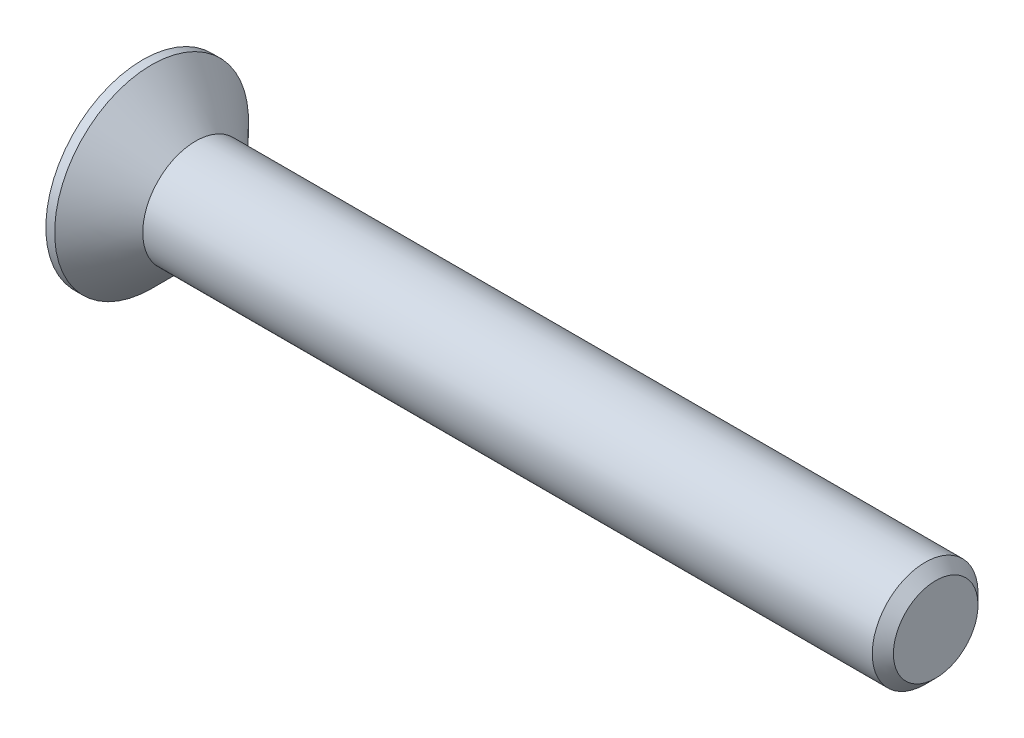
SolidWorks part; units mm, degrees
ref_plane "Front Plane" through (0, 0, 0) normal (0, 0, 1) x (1, 0, 0)
ref_plane "Top Plane" through (0, 0, 0) normal (0, 1, 0) x (1, 0, 0)
ref_plane "Right Plane" through (0, 0, 0) normal (1, 0, 0) x (0, 0, -1)
sketch "Sketch1" plane through (0, 0, 0) normal (0, 0, 1) x (1, 0, 0)
  line L1 (-3, 5.5) -> (-3, 0)
  line L2 (-3, 0) -> (42, 0)
  line L3 (42, 0) -> (42, 3)
  line L4 (42, 3) -> (0, 3)
  line L5 (-3, 5.5) -> (-2.5, 5.5)
  line L6 (-2.5, 5.5) -> (0, 3)
  dimension "D1" = 3
  dimension "D2" = 45
  dimension "D3" = 3
  dimension "D4" = 45
  dimension "D5" = 5.5
revolve "Revolve1" add sketch "Sketch1" angle 360 about L2
chamfer "Chamfer1" distance 0.6 angle 45 1 edges at (42, -3, 0)
sketch "Sketch2" plane through (-3, 0, 0) normal (-1, 0, 0) x (0, 0, 1)
  line L0 (-0.825, 3.3) -> (0.825, 3.3)
  line L1 (0.825, 3.3) -> (0.825, 0.825)
  line L2 (0.825, 0.825) -> (3.3, 0.825)
  line L3 (3.3, 0.825) -> (3.3, -0.825)
  line L4 (3.3, -0.825) -> (0.825, -0.825)
  line L5 (0.825, -0.825) -> (0.825, -3.3)
  line L6 (0.825, -3.3) -> (-0.825, -3.3)
  line L7 (-0.825, -3.3) -> (-0.825, -0.825)
  line L8 (-0.825, -0.825) -> (-3.3, -0.825)
  line L9 (-3.3, -0.825) -> (-3.3, 0.825)
  line L10 (-3.3, 0.825) -> (-0.825, 0.825)
  line L11 (-0.825, 0.825) -> (-0.825, 3.3)
  point P2 (0, 3.3)
  point P14 (0, -3.3)
  point P15 (3.3, 0)
  point P16 (-3.3, 0)
  dimension "D1" = 6.6
  dimension "D2" = 1.65
extrude "Cut-Extrude1" cut sketch "Sketch2" against normal blind 2.5
